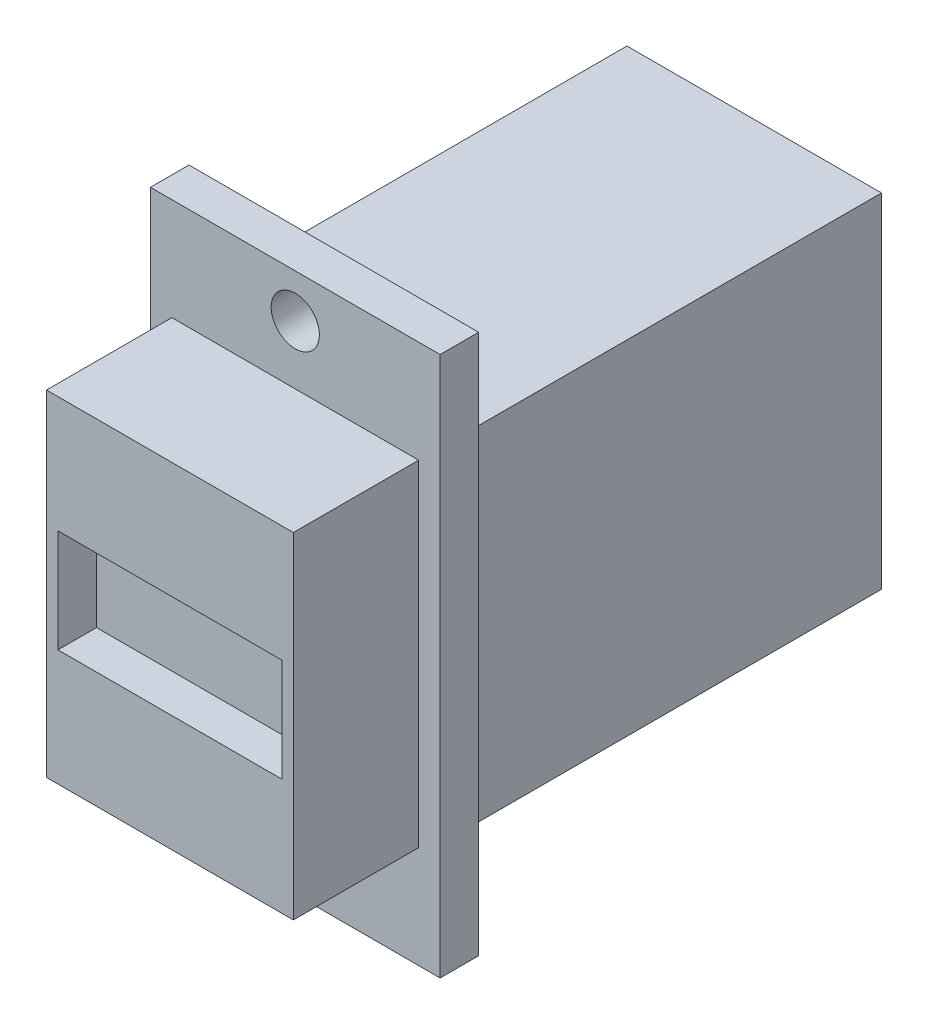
SolidWorks part; units mm, degrees
ref_plane "Front Plane" through (0, 0, 0) normal (0, 0, 1) x (1, 0, 0)
ref_plane "Top Plane" through (0, 0, 0) normal (0, 1, 0) x (1, 0, 0)
ref_plane "Right Plane" through (0, 0, 0) normal (1, 0, 0) x (0, 0, -1)
sketch "Sketch1" plane through (0, 0, 0) normal (0, 0, 1) x (1, 0, 0)
  line L1 (-9.5398, -17.78) -> (9.5398, -17.78)
  line L2 (-9.5398, -17.78) -> (-9.5398, 17.78)
  line L3 (-9.5398, 17.78) -> (9.5398, 17.78)
  line L4 (9.5398, -17.78) -> (9.5398, 17.78)
  line L5 (-9.5398, -17.78) -> (9.5398, 17.78) construction
  line L6 (-9.5398, 17.78) -> (9.5398, -17.78) construction
  circle A0 centre (0, 14.9225) radius 1.5875
  circle A1 centre (0, -14.605) radius 1.5875
  point P0 (0, 0)
  point P12 (0, 16.51)
extrude "Boss-Extrude2" add sketch "Sketch1" along normal blind 2.54 contours L2 L1 L4 L3 | A0 | A1
sketch "Sketch2" plane through (0, 0, 2.54) normal (0, 0, 1) x (1, 0, 0)
  line L1 (-8.128, -11.049) -> (8.128, -11.049)
  line L2 (-8.128, -11.049) -> (-8.128, 11.049)
  line L3 (-8.128, 11.049) -> (8.128, 11.049)
  line L4 (8.128, -11.049) -> (8.128, 11.049)
  line L5 (-8.128, -11.049) -> (8.128, 11.049) construction
  line L6 (-8.128, 11.049) -> (8.128, -11.049) construction
  point P0 (0, 0)
extrude "Boss-Extrude3" add sketch "Sketch2" along normal blind 8.255
sketch "Sketch3" plane through (0, 0, 0) normal (0, 0, -1) x (-1, 0, 0)
  line L1 (-8.382, -11.303) -> (8.382, -11.303)
  line L2 (-8.382, -11.303) -> (-8.382, 11.303)
  line L3 (-8.382, 11.303) -> (8.382, 11.303)
  line L4 (8.382, -11.303) -> (8.382, 11.303)
  line L5 (-8.382, -11.303) -> (8.382, 11.303) construction
  line L6 (-8.382, 11.303) -> (8.382, -11.303) construction
  point P0 (0, 0)
extrude "Boss-Extrude4" add sketch "Sketch3" along normal blind 27.686
sketch "Sketch4" plane through (0, 0, 10.795) normal (0, 0, 1) x (1, 0, 0)
  line L1 (-7.3741, -3.3937) -> (7.3741, -3.3937)
  line L2 (-7.3741, -3.3937) -> (-7.3741, 3.3937)
  line L3 (-7.3741, 3.3937) -> (7.3741, 3.3937)
  line L4 (7.3741, -3.3937) -> (7.3741, 3.3937)
  line L5 (-7.3741, -3.3937) -> (7.3741, 3.3937) construction
  line L6 (-7.3741, 3.3937) -> (7.3741, -3.3937) construction
  point P0 (0, 0)
extrude "Cut-Extrude1" cut sketch "Sketch4" against normal blind 2.54
